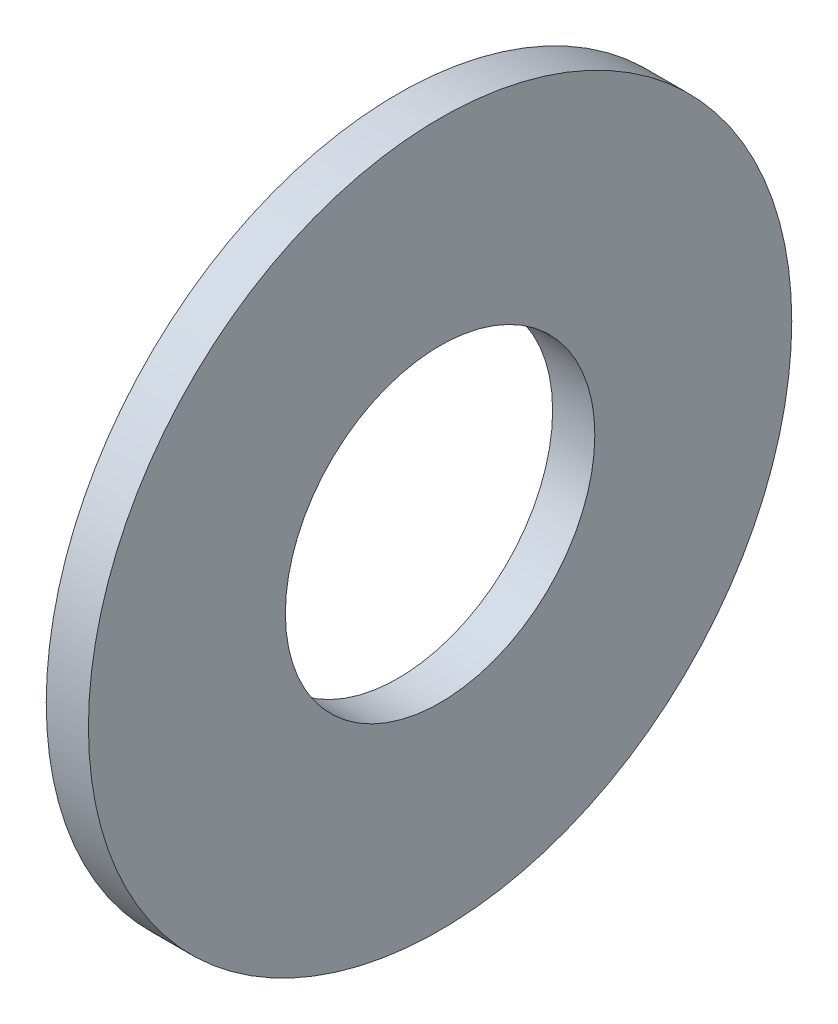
SolidWorks part; units mm, degrees
ref_plane "Plane1" through (0, 0, 0) normal (0, 0, 1) x (1, 0, 0)
ref_plane "Plane2" through (0, 0, 0) normal (0, 1, 0) x (1, 0, 0)
ref_plane "Plane3" through (0, 0, 0) normal (1, 0, 0) x (0, 0, -1)
revolve "Base-Revolve" add sketch "Sketch1" angle 360 about L0
sketch "Sketch1" plane through (0, 0, 0) normal (0, 0, 1) x (1, 0, 0)
  line L0 (-34.925, 0) -> (9.525, 0) construction
  line L1 (0, 1.1) -> (0, 2.5)
  line L2 (0, 2.5) -> (-0.3, 2.5)
  line L3 (-0.3, 2.5) -> (-0.3, 1.1)
  line L4 (-0.3, 1.1) -> (0, 1.1)
  dimension "Thickness" = 0.3
  dimension "Inside_dia" = 2.2
  dimension "Outside_dia" = 5
